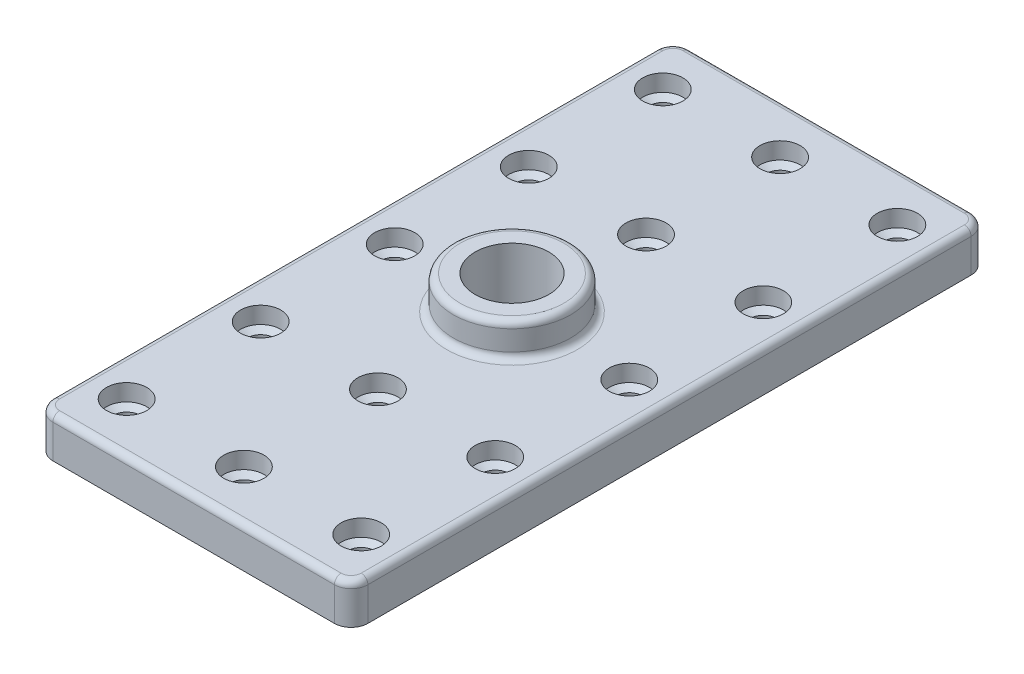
SolidWorks part; units mm, degrees
ref_plane "Front" through (0, 0, 0) normal (0, 0, 1) x (1, 0, 0)
ref_plane "Top" through (0, 0, 0) normal (0, 1, 0) x (1, 0, 0)
ref_plane "Right" through (0, 0, 0) normal (1, 0, 0) x (0, 0, -1)
sketch "Sketch1" plane through (0, 0, 0) normal (0, 1, 0) x (1, 0, 0)
  line L0 (-47, 95) -> (47, -95) construction
  line L1 (-47, -95) -> (47, -95)
  line L2 (-47, -95) -> (-47, 95)
  line L3 (-47, 95) -> (47, 95)
  line L4 (47, -95) -> (47, 95)
  dimension "D1" = 190
  dimension "D2" = 94
extrude "plate" add sketch "Sketch1" along normal blind 12
sketch "Sketch2" plane through (0, 12, 0) normal (0, 1, 0) x (-1, 0, 0)
  circle A0 centre (0, 0) radius 17.5
  dimension "D1" = 35
extrude "boss" add sketch "Sketch2" along normal blind 10
sketch "Sketch3" plane through (0, 22, 0) normal (0, 1, 0) x (-1, 0, 0)
  circle A0 centre (0, 0) radius 11
  dimension "D1" = 22
extrude "center hole" cut sketch "Sketch3" against normal through all
hole_wizard "pattern hole" positions "Sketch5" profile "Sketch4" legacy
sketch "Sketch5" plane through (0, 12, 0) normal (0, 1, 0) x (-1, 0, 0)
  line L0 (47, 95) -> (-47, 95) construction
  line L1 (47, -95) -> (47, 95) construction
  point P0 (35, 80)
  dimension "D1" = 15
  dimension "D2" = 12
sketch "Sketch4" plane through (-35, 12, 80) normal (1, 0, 0) x (0, 0, 1)
  line L0 (0, 0) -> (0, 12)
  line L1 (0, 12) -> (4, 12)
  line L2 (4, 12) -> (4, 6.2017)
  line L3 (4, 6.2017) -> (6, 5)
  line L4 (6, 5) -> (6, 0)
  line L5 (6, 0) -> (0, 0)
  line L6 (0, -6.13) -> (0, 109.2824) construction
  line L7 (-4, 6.2017) -> (-6, 5) construction
  line L8 (0, 12) -> (-4, 12) construction
  dimension "Diameter" = 8
  dimension "Depth" = 12
  dimension "C-Drill Diameter" = 12
  dimension "C-Drill Depth" = 5
  dimension "C-Drill Angle" = 118
fillet "R5" radius 5 4 edges at (-47, 6, -95) (47, 6, -95) (47, 6, 95) (-47, 6, 95)
fillet "R2" radius 2 10 edges at (0, 12, -17.5) (0, 22, 17.5) (47, 12, 0) (0, 12, 95) (-47, 12, 0) (0, 12, -95) (45.5355, 12, -93.5355) (-45.5355, 12, -93.5355) (-45.5355, 12, 93.5355) (45.5355, 12, 93.5355)
pattern_linear "LPattern2" count 5 spacing 40 along (0, 0, -1) count 3 spacing 35 along (1, 0, 0) of "pattern hole"
